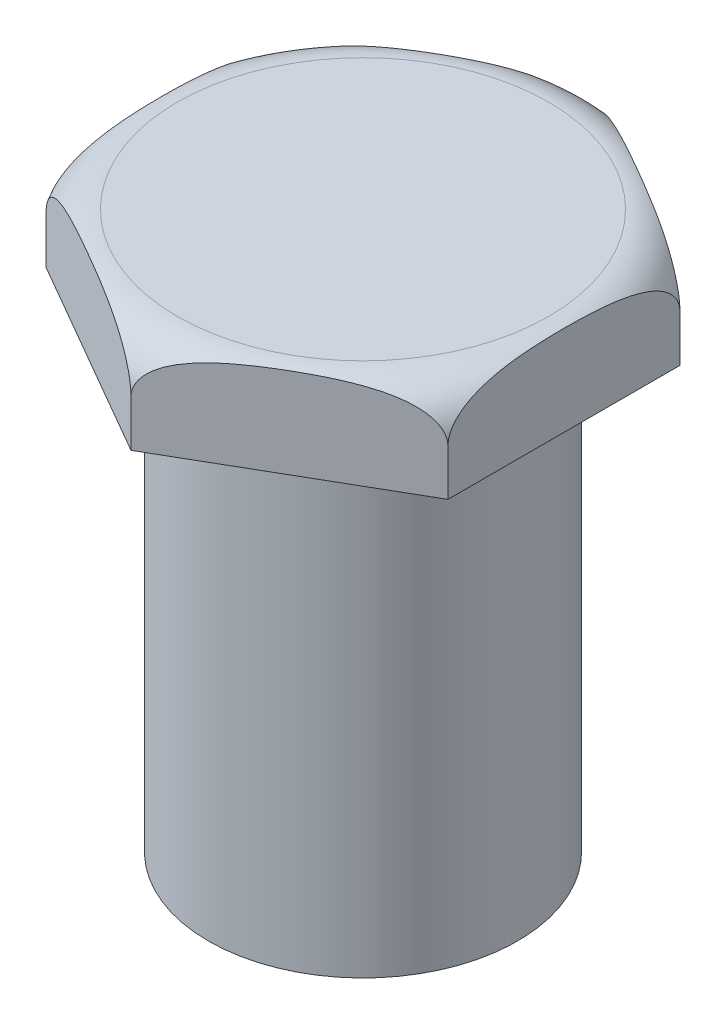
SolidWorks part; units mm, degrees
ref_plane "Front" through (0, 0, 0) normal (0, 0, 1) x (1, 0, 0)
ref_plane "Top" through (0, 0, 0) normal (0, 1, 0) x (1, 0, 0)
ref_plane "Right" through (0, 0, 0) normal (1, 0, 0) x (0, 0, -1)
sketch "Sketch1" plane through (0, 0, 0) normal (0, 1, 0) x (1, 0, 0)
  circle A0 centre (0, 0) radius 5
  dimension "D1" = 10
extrude "Extrude1" add sketch "Sketch1" along normal blind 15
sketch "Sketch2" plane through (0, 15, 0) normal (0, 1, 0) x (-1, 0, 0)
  line L1 (0, 7.5056) -> (-6.5, 3.7528)
  line L2 (-6.5, 3.7528) -> (-6.5, -3.7528)
  line L3 (-6.5, -3.7528) -> (0, -7.5056)
  line L4 (0, -7.5056) -> (6.5, -3.7528)
  line L5 (6.5, -3.7528) -> (6.5, 3.7528)
  line L6 (6.5, 3.7528) -> (0, 7.5056)
  circle A0 centre (0, 0) radius 6.5 construction
  dimension "D1" = 13
extrude "Extrude2" add sketch "Sketch2" along normal blind 3
sketch "Sketch3" plane through (0, 0, 0) normal (1, 0, 0) x (0, 0, -1)
  line L2 (0, 0) -> (0, 34.5814) construction
  line L9 (6.0056, 18) -> (6.0056, 18.9478)
  line L10 (6.0056, 18.9478) -> (9.5136, 19.1389)
  line L11 (9.5136, 19.1389) -> (9.1916, 16.3082)
  line L12 (9.1916, 16.3082) -> (7.5056, 16.5)
  arc A0 (7.5056, 16.5) -> (6.0056, 18) centre (6.0056, 16.5) ccw
  dimension "D1" = 1.5
revolve "Cut-Revolve1" cut sketch "Sketch3" angle 360 about L2
